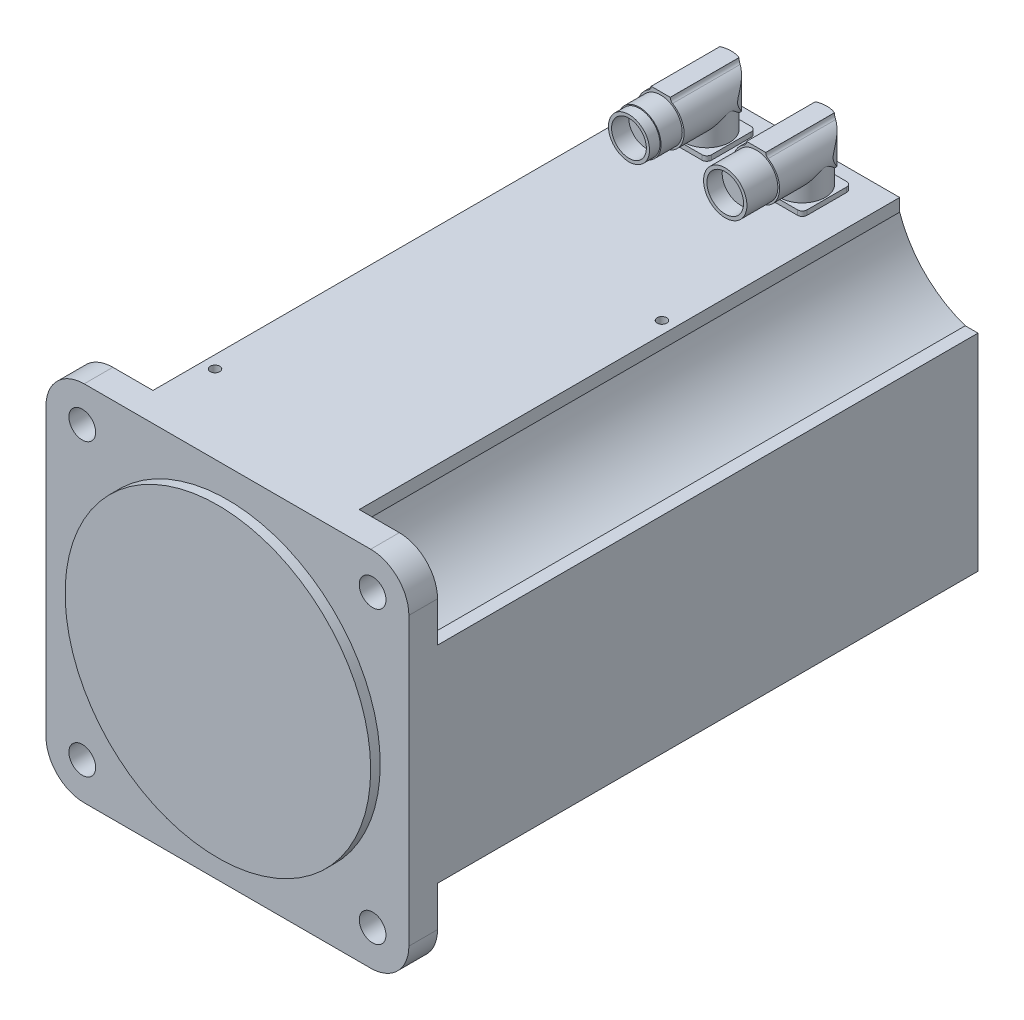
SolidWorks part; units mm, degrees
ref_plane "Piano1 (Front/Back)" through (0, 0, 0) normal (0, 0, 1) x (1, 0, 0)
ref_plane "Piano2 (Top/Bottom)" through (0, 0, 0) normal (0, 1, 0) x (1, 0, 0)
ref_plane "Piano3 (Left/Right)" through (0, 0, 0) normal (1, 0, 0) x (0, 0, -1)
imported_body "Importato1"
hole_wizard "M6 Foro filettato profondo1" positions "Schizzo2" profile "Schizzo1" tap size "M6" standard "ISO"
sketch "Schizzo2" plane through (0, 95, 0) normal (0, 1, 0) x (-1, 0, 0)
  line L0 (80, 15.75) -> (-80, 15.75) construction
  point P0 (47.5, -25.25)
  point P1 (-47.5, -164.25)
  dimension "D1" = 41
  dimension "D2" = 139
  dimension "D3" = 47.5
  dimension "D4" = 47.5
sketch "Schizzo1" plane through (-47.5, 95, -25.25) normal (1, 0, 0) x (0, 0, 1)
  line L0 (0, 0) -> (0, 18.5022)
  line L1 (0, 18.5022) -> (2.5, 17)
  line L2 (2.5, 17) -> (2.5, 0)
  line L5 (2.5, 0) -> (0, 0)
  line L10 (0, 18.5022) -> (-2.5, 17) construction
  line L11 (0, -6.35) -> (0, 107.95) construction
  dimension "Tap Drill Dia." = 5
  dimension "Tap Drill Depth" = 17
  dimension "Drill Angle" = 118
